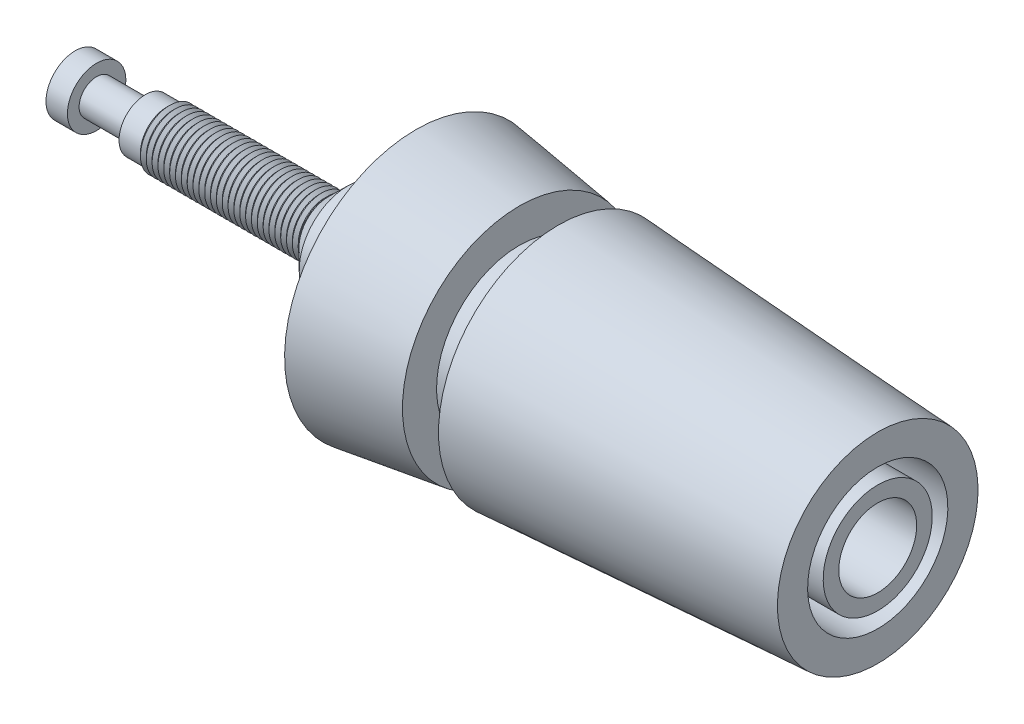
SolidWorks part; units mm, degrees
ref_plane "Přední rovina" through (0, 0, 0) normal (0, 0, 1) x (1, 0, 0)
ref_plane "Horní rovina" through (0, 0, 0) normal (0, 1, 0) x (1, 0, 0)
ref_plane "Pravá rovina" through (0, 0, 0) normal (1, 0, 0) x (0, 0, -1)
sketch "Skica1" plane through (0, 0, 0) normal (0, 0, 1) x (1, 0, 0)
  line L0 (-41.2501, 0) -> (-41.2501, 1.5)
  line L1 (-41.2501, 1.5) -> (-40.1501, 1.5)
  line L2 (-40.1501, 1.5) -> (-40.1501, 0.9)
  line L3 (-40.1501, 0.9) -> (-37.6501, 0.9)
  line L4 (-37.6501, 0.9) -> (-37.6501, 1.35)
  line L5 (-37.6501, 1.35) -> (-36.5501, 1.35)
  line L6 (-36.5501, 1.35) -> (-36.4001, 1.5)
  line L7 (-36.4001, 1.5) -> (-36.2501, 1.35)
  line L8 (-36.2501, 1.35) -> (-36.1001, 1.5)
  line L9 (-36.1001, 1.5) -> (-35.9501, 1.35)
  line L10 (-35.9501, 1.35) -> (-35.8001, 1.5)
  line L11 (-35.8001, 1.5) -> (-35.6501, 1.35)
  line L12 (-35.6501, 1.35) -> (-35.5001, 1.5)
  line L13 (-35.5001, 1.5) -> (-35.3501, 1.35)
  line L14 (-35.3501, 1.35) -> (-35.2001, 1.5)
  line L15 (-27.2501, 2.5) -> (-24.2501, 2.5)
  line L16 (-24.2501, 2.5) -> (-24.2501, 4.5)
  line L17 (-24.2501, 4.5) -> (-23.7501, 4.5)
  line L18 (-23.7501, 4.5) -> (-23.7501, 6.75)
  line L19 (-23.7501, 6.75) -> (-18.4501, 6)
  line L20 (-18.4501, 6) -> (-18.4501, 4.25)
  line L21 (-18.4501, 4.25) -> (-16.4501, 4.25)
  line L22 (-16.4501, 4.25) -> (-16.4501, 6.15)
  line L23 (-16.4501, 6.15) -> (-0.0501, 5.15)
  line L24 (-0.0501, 5.15) -> (-0.0501, 0)
  line L25 (-0.0501, 0) -> (-41.2501, 0)
  line L26 (-35.2001, 1.5) -> (-35.0501, 1.35)
  line L27 (-35.0501, 1.35) -> (-34.9001, 1.5)
  line L28 (-34.9001, 1.5) -> (-34.7501, 1.35)
  line L29 (-34.7501, 1.35) -> (-34.6001, 1.5)
  line L30 (-34.6001, 1.5) -> (-34.4501, 1.35)
  line L31 (-34.4501, 1.35) -> (-34.3001, 1.5)
  line L32 (-34.3001, 1.5) -> (-34.1501, 1.35)
  line L33 (-34.1501, 1.35) -> (-34.0001, 1.5)
  line L34 (-34.0001, 1.5) -> (-33.8501, 1.35)
  line L35 (-33.8501, 1.35) -> (-33.7001, 1.5)
  line L36 (-33.7001, 1.5) -> (-33.5501, 1.35)
  line L37 (-33.5501, 1.35) -> (-33.4001, 1.5)
  line L38 (-33.4001, 1.5) -> (-33.2501, 1.35)
  line L39 (-33.2501, 1.35) -> (-33.1001, 1.5)
  line L40 (-33.1001, 1.5) -> (-32.9501, 1.35)
  line L41 (-32.9501, 1.35) -> (-32.8001, 1.5)
  line L42 (-32.8001, 1.5) -> (-32.6501, 1.35)
  line L43 (-32.6501, 1.35) -> (-32.5001, 1.5)
  line L44 (-32.5001, 1.5) -> (-32.3501, 1.35)
  line L45 (-32.3501, 1.35) -> (-32.2001, 1.5)
  line L46 (-32.2001, 1.5) -> (-32.0501, 1.35)
  line L47 (-32.0501, 1.35) -> (-31.9001, 1.5)
  line L48 (-31.9001, 1.5) -> (-31.7501, 1.35)
  line L49 (-31.7501, 1.35) -> (-31.6001, 1.5)
  line L50 (-31.6001, 1.5) -> (-31.4501, 1.35)
  line L51 (-31.4501, 1.35) -> (-31.3001, 1.5)
  line L52 (-31.3001, 1.5) -> (-31.1501, 1.35)
  line L53 (-31.1501, 1.35) -> (-31.0001, 1.5)
  line L54 (-31.0001, 1.5) -> (-30.8501, 1.35)
  line L55 (-30.8501, 1.35) -> (-30.7001, 1.5)
  line L56 (-30.7001, 1.5) -> (-30.5501, 1.35)
  line L57 (-30.5501, 1.35) -> (-30.4001, 1.5)
  line L58 (-30.4001, 1.5) -> (-30.2501, 1.35)
  line L59 (-30.2501, 1.35) -> (-30.1001, 1.5)
  line L60 (-30.1001, 1.5) -> (-29.9501, 1.35)
  line L61 (-29.9501, 1.35) -> (-29.8001, 1.5)
  line L62 (-29.8001, 1.5) -> (-29.6501, 1.35)
  line L63 (-29.6501, 1.35) -> (-29.5001, 1.5)
  line L64 (-29.5001, 1.5) -> (-29.3501, 1.35)
  line L65 (-29.3501, 1.35) -> (-29.2001, 1.5)
  line L66 (-29.2001, 1.5) -> (-29.0501, 1.35)
  line L67 (-29.0501, 1.35) -> (-28.9001, 1.5)
  line L68 (-28.9001, 1.5) -> (-28.7501, 1.35)
  line L69 (-28.7501, 1.35) -> (-28.6001, 1.5)
  line L70 (-28.6001, 1.5) -> (-28.4501, 1.35)
  line L71 (-28.4501, 1.35) -> (-28.3001, 1.5)
  line L72 (-28.3001, 1.5) -> (-28.2618, 1.5)
  line L73 (-28.2618, 1.5) -> (-27.2501, 2.5)
  dimension "D1" = 1.5
  dimension "D2" = 2.5
  dimension "D3" = 1.1
  dimension "D4" = 0.9
  dimension "D5" = 1.35
  dimension "D6" = 1.1
  dimension "D7" = 2.5
  dimension "D8" = 9.3
  dimension "D9" = 17
  dimension "D10" = 0.5
  dimension "D11" = 6.75
  dimension "D12" = 4.5
  dimension "D13" = 6
  dimension "D14" = 5.3
  dimension "D15" = 4.25
  dimension "D16" = 2
  dimension "D17" = 6.15
  dimension "D18" = 5.15
  dimension "D19" = 16.4
revolve "Rotovat1" add sketch "Skica1" angle 360 about L25
sketch "Skica3" plane through (-0.0501, 0, 0) normal (1, 0, 0) x (0, 0, -1)
  circle A0 centre (0, 0) radius 2
  circle A1 centre (0, 0) radius 2.8
  circle A2 centre (0, 0) radius 3.6
  dimension "D1" = 4
  dimension "D2" = 7.2
  dimension "D3" = 5.6
extrude "Odebrat vysunutím1" cut sketch "Skica3" against normal blind 16 contours A0 | A2 A1
sketch "Skica4" plane through (-24.2501, 0, 0) normal (-1, 0, 0) x (0, 0, 1)
  line L0 (3.9, 2.245) -> (3.9, -2.245)
  circle A0 centre (0, 0) radius 4.5 construction
  dimension "D1" = 3.9
extrude "Odebrat vysunutím4" cut sketch "Skica4" against normal up to surface (0.5 mm away) contours L0 M2
